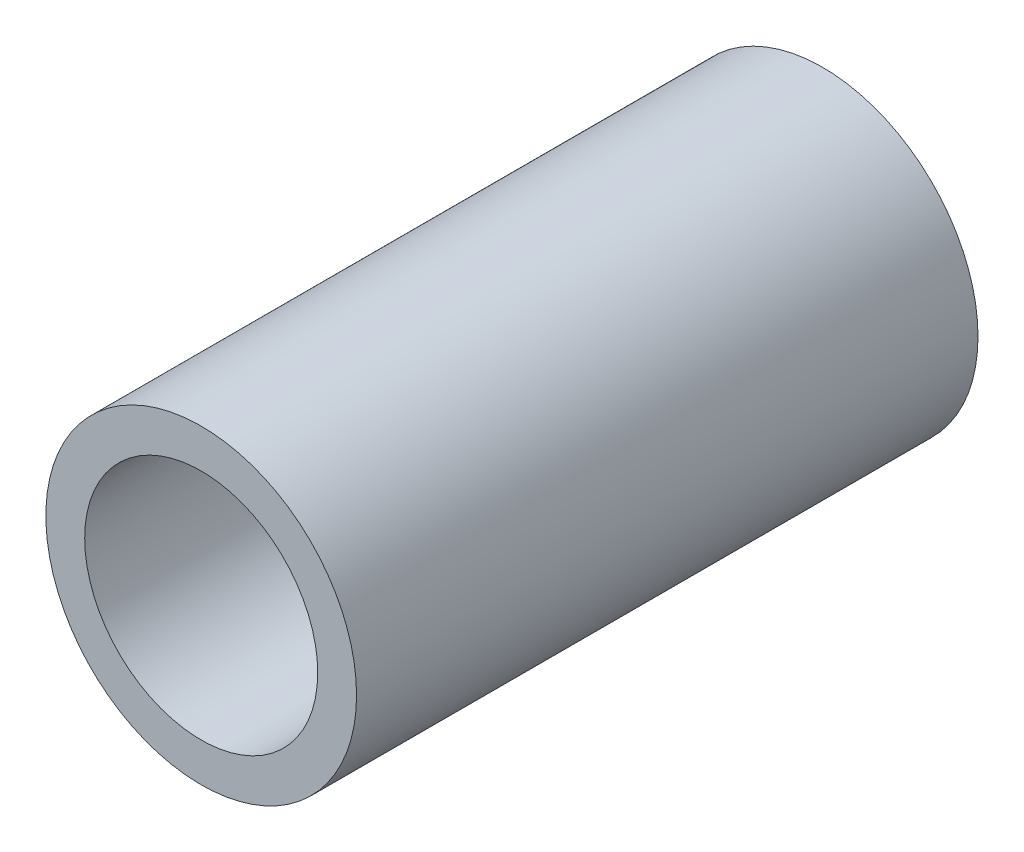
SolidWorks part; units mm, degrees
ref_plane "Plan de face" through (0, 0, 0) normal (0, 0, 1) x (1, 0, 0)
ref_plane "Plan de dessus" through (0, 0, 0) normal (0, 1, 0) x (1, 0, 0)
ref_plane "Plan de droite" through (0, 0, 0) normal (1, 0, 0) x (0, 0, -1)
sketch "Esquisse1" plane through (0, 0, 0) normal (0, 0, 1) x (1, 0, 0)
  circle A0 centre (0, 0) radius 1.5
  circle A1 centre (0, 0) radius 2
  dimension "D1" = 3
  dimension "D2" = 4
extrude "Extrusion1" add sketch "Esquisse1" along normal mid plane 8
